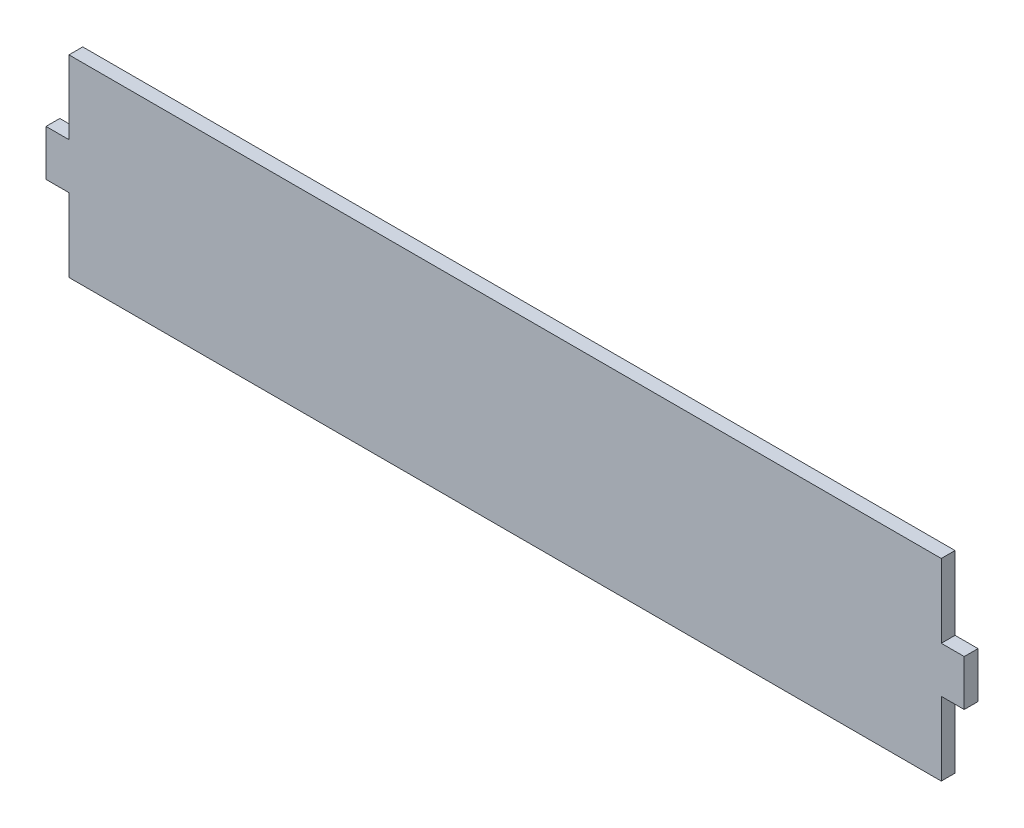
SolidWorks part; units mm, degrees
ref_plane "Front Plane" through (0, 0, 0) normal (0, 0, 1) x (1, 0, 0)
ref_plane "Top Plane" through (0, 0, 0) normal (0, 1, 0) x (1, 0, 0)
ref_plane "Right Plane" through (0, 0, 0) normal (1, 0, 0) x (0, 0, -1)
sketch "Sketch1" plane through (0, 0, 0) normal (0, 0, 1) x (1, 0, 0)
  line L0 (-107.0586, 12.7) -> (-107.0586, 33.02)
  line L1 (-107.0586, 33.02) -> (134.2414, 33.02)
  line L2 (-107.0586, 0) -> (-107.0586, -20.32)
  line L3 (-107.0586, -20.32) -> (134.2414, -20.32)
  line L4 (134.2414, 12.7) -> (134.2414, 33.02)
  line L5 (-113.4086, 12.7) -> (-107.0586, 12.7)
  line L6 (-113.4086, 12.7) -> (-113.4086, 0)
  line L7 (-113.4086, 0) -> (-107.0586, 0)
  line L9 (134.2414, 12.7) -> (140.5914, 12.7)
  line L11 (134.2414, 0) -> (140.5914, 0)
  line L12 (140.5914, 12.7) -> (140.5914, 0)
  line L13 (134.2414, 0) -> (134.2414, -20.32)
  dimension "D1" = 241.3
  dimension "D2" = 53.34
  dimension "D3" = 20.32
  dimension "D4" = 12.7
  dimension "D5" = 20.32
  dimension "D6" = 12.7
  dimension "D7" = 20.32
extrude "Extrude1" add sketch "Sketch1" along normal blind 3.81
